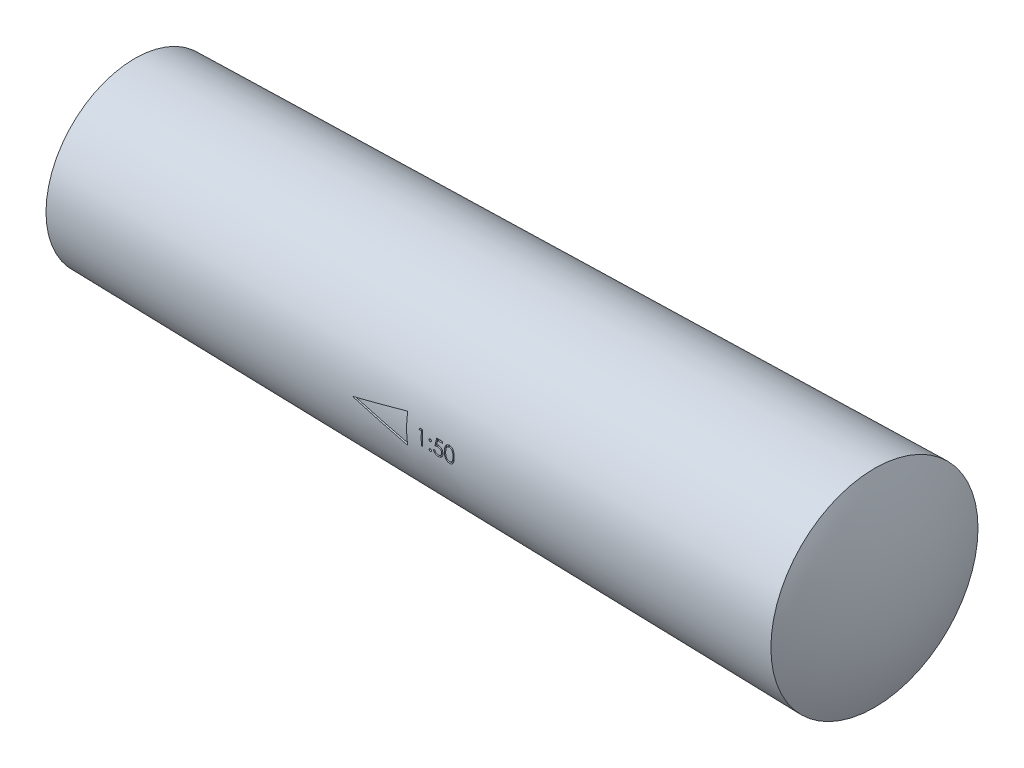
SolidWorks part; units mm, degrees
ref_plane "Front Plane" through (0, 0, 0) normal (0, 0, 1) x (1, 0, 0)
ref_plane "Top Plane" through (0, 0, 0) normal (0, 1, 0) x (1, 0, 0)
ref_plane "Right Plane" through (0, 0, 0) normal (1, 0, 0) x (0, 0, -1)
sketch "Sketch1" plane through (0, 0, 0) normal (1, 0, 0) x (0, 0, -1)
  circle A0 centre (0, 0) radius 6
  dimension "D1" = 12
extrude "Extrude1" add sketch "Sketch1" along normal mid plane 50
draft "Draft1" type of draft neutral plane draft angle 1.146 faces to draft 1 parameters "D1"=1.146
sketch "Sketch2" plane through (0, 0, 0) normal (0, 0, 1) x (1, 0, 0)
  line L0 (-25, 0) -> (-25, 6)
  line L1 (-25, 6) -> (-25, -6) construction
  line L2 (-25, 0) -> (-26.6, 0)
  line L3 (-26.6, 0) -> (-26.6, -6.5) construction
  line L4 (25, 0) -> (25, 7)
  line L5 (25, -7) -> (25, 7) construction
  line L6 (25, 0) -> (26.6, 0)
  line L7 (26.6, 0) -> (26.6, -6.5) construction
  line L8 (-25, -6) -> (25, -7) construction
  arc A0 (-26.6, 0) -> (-25, 6) centre (-14.55, 0) cw
  arc A1 (26.6, 0) -> (25, 7) centre (10.4874, 0) ccw
  point P14 (0, -6.5)
revolve "Revolve1" add sketch "Sketch2" angle 360 about L2
sketch "Sketch5" plane through (0, 0, 0) normal (0, 0, 1) x (1, 0, 0)
  line L0 (0, 6.5) -> (0, -6.5) construction
  line L1 (25, 7) -> (-25, 6) construction
  line L2 (-25, -6) -> (25, -7) construction
ref_plane "Plane2" through (0, 0, 0) normal (-0.02, 0, 0.9998) x (0.9998, 0, 0.02)
sketch "Sketch6" plane through (0, 0, 0) normal (-0.02, 0, 0.9998) x (0.9998, 0, 0.02)
  line L0 (0, 0) -> (0, 1)
  line L1 (0, 6.5) -> (0, -6.5) construction
  line L2 (0, 1) -> (-3.7321, 0)
  line L3 (-3.7321, 0) -> (0, -1)
  line L4 (0, -1) -> (0, 0)
  line L5 (0, -0.5) -> (4, -0.5) construction
  text T0 "1:50" font "Century Gothic" height 1
  dimension "D1" = 2
  dimension "D2" = 30
  dimension "D3" = 4
wrap "Wrap2" sketch "Sketch6" wrap type deboss source sketch "Sketch6" thickness 0.1 parameters "D1"=0.1
equation "\"D2@Sketch2\" = \"D1@Sketch2\""
